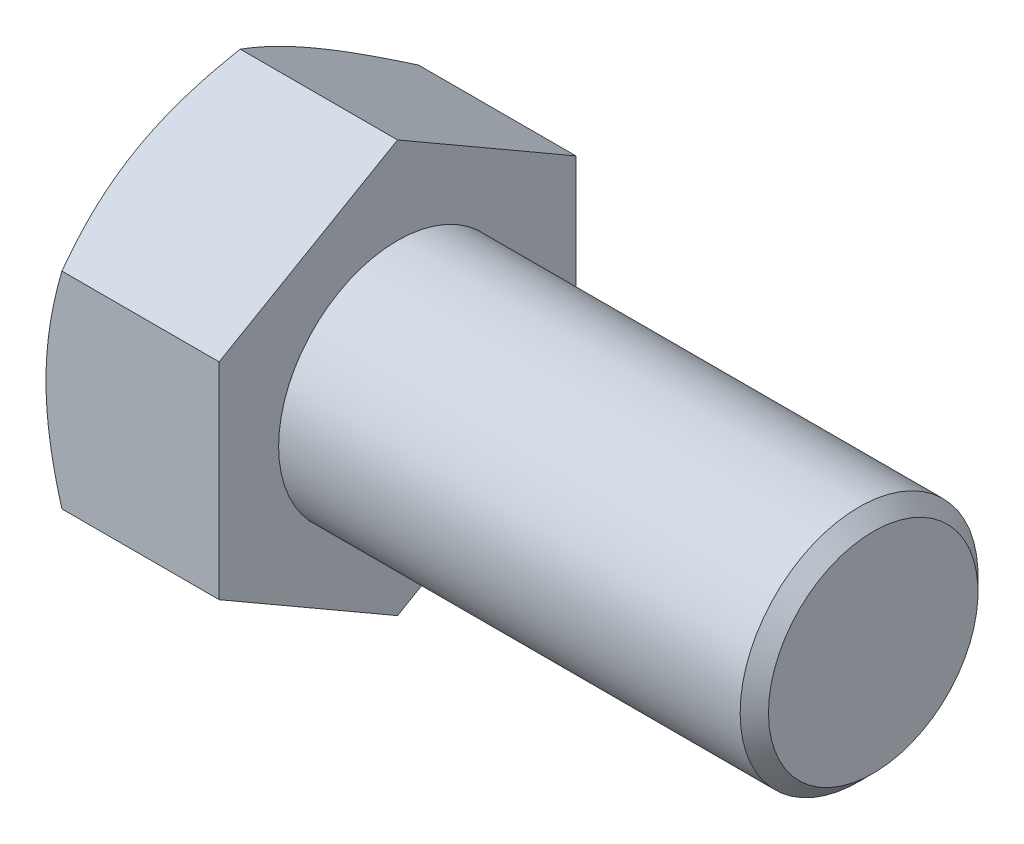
SolidWorks part; units mm, degrees
extrude "BaseHead" add sketch "Sketch1" along normal blind 9.2456
sketch "Sketch1" plane through (0, 0, 0) normal (1, 0, 0) x (0, 0, -1)
  line L0 (9.525, 5.4993) -> (9.525, -5.4993)
  line L1 (-9.525, 5.4993) -> (-9.525, -5.4993)
  line L2 (9.525, -5.4993) -> (0, -10.9985)
  line L3 (0, -10.9985) -> (-9.525, -5.4993)
  line L4 (9.525, 5.4993) -> (0, 10.9985)
  line L5 (0, 10.9985) -> (-9.525, 5.4993)
ref_plane "Plane1" through (0, 0, 0) normal (0, 0, 1) x (1, 0, 0)
ref_plane "Plane2" through (0, 0, 0) normal (0, 1, 0) x (1, 0, 0)
ref_plane "Plane3" through (0, 0, 0) normal (1, 0, 0) x (0, 0, -1)
other "Configuration Table"
sketch "BodySke" plane through (0, 0, 0) normal (0, 0, 1) x (1, 0, 0)
  line L0 (0, 5.4993) -> (0, -5.4993) construction
  line L1 (0, 0) -> (34.6456, 0)
  line L2 (0, 0) -> (0, 6.35)
  line L3 (0, 6.35) -> (33.8899, 6.35)
  line L4 (34.6456, 0) -> (34.6456, 5.5943)
  line L5 (9.2456, 10.9985) -> (9.2456, 5.4993) construction
  line L6 (34.6456, 5.5943) -> (33.8899, 6.35)
  line L7 (0, 0) -> (96.52, 0) construction
  line L8 (34.6456, -5.5943) -> (33.8899, -6.35) construction
  line L9 (0, -6.35) -> (33.8899, -6.35) construction
  line L10 (10.5156, 15.24) -> (10.5156, -2.54) construction
  line L11 (9.2456, 15.24) -> (9.2456, -2.54) construction
  line L12 (9.2456, 5.4993) -> (9.2456, -5.4993) construction
revolve "BaseBody" add sketch "BodySke" angle 360 about L7
sketch "Sketch3" plane through (0, 0, 0) normal (0, 0, 1) x (1, 0, 0)
  line L0 (0, 9.525) -> (4.5169, 17.3485)
  line L1 (0, 10.9985) -> (0, 5.4993) construction
  line L2 (4.5169, 17.3485) -> (4.5169, 23.6985)
  line L3 (4.5169, 23.6985) -> (-12.7, 23.6985)
  line L4 (-12.7, 23.6985) -> (-12.7, 9.525)
  line L5 (-12.7, 9.525) -> (0, 9.525)
  line L6 (0, 0) -> (99.06, 0) construction
  line L7 (9.2456, 10.9985) -> (0, 10.9985) construction
revolve "HeadChamfer" cut sketch "Sketch3" angle 360 about L6
fillet "HeadFillet" [suppressed] radius 0.762
sketch "ThdSchSke" plane through (0, 0, 0) normal (0, 0, 1) x (1, 0, 0)
  line L0 (10.5156, -5.5943) -> (9.9865, -6.35)
  line L1 (10.5156, -5.5943) -> (11.0447, -6.35)
  line L2 (11.0447, -6.35) -> (11.0447, -7.9375)
  line L3 (-3.175, 0) -> (5.1513, 0) construction
  line L5 (11.0447, -7.9375) -> (9.9865, -7.9375)
  line L6 (9.9865, -7.9375) -> (9.9865, -6.35)
revolve "ThreadSchematic" [suppressed] cut sketch "ThdSchSke" angle 360 about L3
pattern_linear "ThdSchPat" [suppressed]
equation "\"D3@Sketch1\" = \"Width_flats@Sketch1\" / 2"
equation "\"D4@Sketch1\" = \"D3@Sketch1\""
equation "\"D5@Sketch1\" = \"D4@Sketch1\""
equation "\"Thread_minor@ThreadCosmetic\" = \"Minor_dia@BodySke\""
equation "\"D1@Sketch3\" = \"Width_flats@Sketch1\" / 2"
equation "\"Thread_length@ThreadCosmetic\" = ((sgn( (\"Length@BodySke\" - \"Advance@BodySke\" ) - \"Thread_nom@BodySke\" )-1)*( (\"Length@BodySke\" - \"Advance@BodySke\" ) - \"Thread_nom@BodySke\" ))/-2+ \"Thread_nom@BodySke\""
equation "\"Thread_minor@ThdSchSke\" = \"Minor_dia@BodySke\""
equation "\"Diameter@ThdSchSke\" = \"Diameter@BodySke\""
equation "\"Overcut@ThdSchSke\" = \"Diameter@BodySke\" * 1.25"
equation "\"Start@ThdSchSke\" = \"Head_ht@BaseHead\" + \"Length@BodySke\" - \"Thread_length@ThreadCosmetic\"  '---Non-countersunk---"
equation "\"Num_threads@ThdSchPat\" = int( \"Thread_length@ThreadCosmetic\" / \"Advance@BodySke\" + 0.999 )  + 1"
equation "\"Advance@ThdSchPat\" = \"Thread_length@ThreadCosmetic\" /  (\"Num_threads@ThdSchPat\" - 1) 'relax it"
equation "\"Num_threads@ThdSchPat\" = \"Num_threads@ThdSchPat\" - sgn( \"Num_threads@ThdSchPat\" - 1) '---chamfered tips only---"
